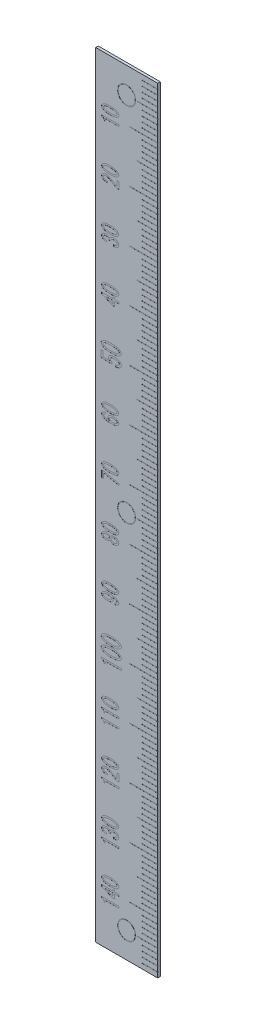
SolidWorks part; units mm, degrees
ref_plane "Front" through (0, 0, 0) normal (0, 0, 1) x (1, 0, 0)
ref_plane "Top" through (0, 0, 0) normal (0, 1, 0) x (1, 0, 0)
ref_plane "Right" through (0, 0, 0) normal (1, 0, 0) x (0, 0, -1)
sketch "Sketch1" plane through (0, 0, 0) normal (0, 0, 1) x (1, 0, 0)
  line L1 (0, 0) -> (0, 150)
  line L2 (0, 0) -> (12, 0)
  line L3 (12, 0) -> (12, 150)
  line L4 (0, 150) -> (12, 150)
  dimension "D1" = 150
  dimension "D2" = 12
extrude "Extrude1" add sketch "Sketch1" along normal blind 0.5
sketch "Sketch2" plane through (0, 0, 0.5) normal (0, 0, 1) x (1, 0, 0)
  line L0 (0, 150) -> (0, 0) construction
  line L1 (0, 0) -> (12, 0) construction
  line L2 (12, 150) -> (0, 150) construction
  circle A0 centre (6, 5) radius 1.75
  circle A1 centre (6, 145) radius 1.75
  circle A2 centre (6, 5) radius 1.65
  circle A3 centre (6, 145) radius 1.65
  circle A4 centre (6, 75) radius 1.75
  circle A5 centre (6, 75) radius 1.65
  dimension "D1" = 6
  dimension "D2" = 6
  dimension "D3" = 5
  dimension "D4" = 5
  dimension "D5" = 3.5
  dimension "D6" = 3.5
  dimension "D7" = 0.1
  dimension "D8" = 2
extrude "Extrude2" cut sketch "Sketch2" against normal blind 0.01
sketch "Sketch3" plane through (0, 0, 0.5) normal (0, 0, 1) x (1, 0, 0)
  line L0 (12, 150) -> (0, 150) construction
  line L1 (1, 138.25) -> (4.5, 138.25) construction
  line L2 (1, 138.25) -> (1, 141.75) construction
  line L3 (1, 141.75) -> (4.5, 141.75) construction
  line L4 (4.5, 138.25) -> (4.5, 141.75) construction
  line L5 (0, 150) -> (0, 0) construction
  line L6 (4.5, 128.25) -> (4.5, 131.75) construction
  line L7 (4.5, 118.25) -> (4.5, 121.75) construction
  line L8 (4.5, 108.25) -> (4.5, 111.75) construction
  line L9 (5, 98.25) -> (5, 101.75) construction
  line L10 (4.5, 88.25) -> (4.5, 91.75) construction
  line L11 (4.5, 78.25) -> (4.5, 81.75) construction
  line L12 (4.5, 68.25) -> (4.5, 71.75) construction
  line L13 (4.5, 58.25) -> (4.5, 61.75) construction
  line L14 (5, 47.2) -> (5, 52.8) construction
  line L15 (4.5, 37.2) -> (4.5, 42.8) construction
  line L16 (12, 0) -> (12, 150) construction
  line L17 (5, 50) -> (-4.9003, 50) construction
  line L18 (4.5, 27.2) -> (4.5, 32.8) construction
  line L19 (4.5, 17.2) -> (4.5, 22.8) construction
  line L20 (4.5, 7.2) -> (4.5, 12.8) construction
  text T0 "10" font "ＭＳ ゴシック" height in points 11
  text T1 "20" font "ＭＳ ゴシック" height in points 11
  text T2 "30" font "ＭＳ ゴシック" height in points 11
  text T3 "40" font "ＭＳ ゴシック" height in points 11
  text T4 "50" font "ＭＳ ゴシック" height in points 13
  text T5 "60  " font "ＭＳ ゴシック" height in points 11
  text T6 "70" font "ＭＳ ゴシック" height in points 11
  text T7 "80" font "ＭＳ ゴシック" height in points 11
  text T8 "90" font "ＭＳ ゴシック" height in points 11
  text T9 "100" font "ＭＳ ゴシック" height in points 13
  text T10 "110" font "ＭＳ ゴシック" height in points 11
  text T11 "120" font "ＭＳ ゴシック" height in points 11
  text T12 "130" font "ＭＳ ゴシック" height in points 11
  text T13 "140" font "ＭＳ ゴシック" height in points 11
  point P4 (4.5, 140)
  dimension "D1" = 3.5
  dimension "D2" = 10
  dimension "D3" = 1
  dimension "D4" = 3.5
  dimension "D8" = 5.6
  dimension "D6" = 7
  dimension "D7" = 7
  dimension "D5" = 4
extrude "Extrude3" cut sketch "Sketch3" against normal blind 0.01
sketch "Sketch4" plane through (0, 0, 0.5) normal (0, 0, 1) x (1, 0, 0)
  line L0 (12, 140.05) -> (6.5, 140.05)
  line L1 (12, 0) -> (12, 150) construction
  line L2 (6.5, 140.05) -> (6.5, 139.95)
  line L3 (6.5, 139.95) -> (12, 139.95)
  line L4 (12, 139.95) -> (12, 140.05)
  line L5 (12, 150) -> (0, 150) construction
  line L6 (12, 148.05) -> (12, 147.95)
  line L7 (12, 144.95) -> (8, 144.95)
  line L8 (12, 144.95) -> (12, 145.05)
  line L9 (12, 145.05) -> (8, 145.05)
  line L10 (8, 144.95) -> (8, 145.05)
  line L11 (12, 149.05) -> (9, 149.05)
  line L12 (12, 149.05) -> (12, 148.95)
  line L13 (12, 148.95) -> (9, 148.95)
  line L14 (9, 149.05) -> (9, 148.95)
  line L15 (12, 148.05) -> (9, 148.05)
  line L16 (12, 147.95) -> (9, 147.95)
  line L17 (9, 148.05) -> (9, 147.95)
  line L18 (12, 147.05) -> (12, 146.95)
  line L19 (12, 147.05) -> (9, 147.05)
  line L20 (12, 146.95) -> (9, 146.95)
  line L21 (9, 147.05) -> (9, 146.95)
  line L22 (12, 146.05) -> (12, 145.95)
  line L23 (12, 146.05) -> (9, 146.05)
  line L24 (12, 145.95) -> (9, 145.95)
  line L25 (9, 146.05) -> (9, 145.95)
  line L26 (12, 130.05) -> (6.5, 130.05)
  line L27 (6.5, 130.05) -> (6.5, 129.95)
  line L28 (6.5, 129.95) -> (12, 129.95)
  line L29 (12, 129.95) -> (12, 130.05)
  line L30 (12, 144.05) -> (12, 143.95)
  line L31 (12, 144.05) -> (9, 144.05)
  line L32 (12, 143.95) -> (9, 143.95)
  line L33 (9, 144.05) -> (9, 143.95)
  line L34 (12, 143.05) -> (12, 142.95)
  line L35 (12, 143.05) -> (9, 143.05)
  line L36 (12, 142.95) -> (9, 142.95)
  line L37 (9, 143.05) -> (9, 142.95)
  line L38 (12, 142.05) -> (12, 141.95)
  line L39 (12, 142.05) -> (9, 142.05)
  line L40 (12, 141.95) -> (9, 141.95)
  line L41 (9, 142.05) -> (9, 141.95)
  line L42 (12, 141.05) -> (12, 140.95)
  line L43 (12, 141.05) -> (9, 141.05)
  line L44 (12, 140.95) -> (9, 140.95)
  line L45 (9, 141.05) -> (9, 140.95)
  line L46 (9, 145.05) -> (9, 144.95)
  line L47 (12, 145.05) -> (9, 145.05)
  line L48 (12, 144.95) -> (9, 144.95)
  line L49 (12, 145.05) -> (12, 144.95)
  line L50 (12, 138.05) -> (12, 137.95)
  line L51 (12, 134.95) -> (8, 134.95)
  line L52 (12, 134.95) -> (12, 135.05)
  line L53 (12, 135.05) -> (8, 135.05)
  line L54 (8, 134.95) -> (8, 135.05)
  line L55 (12, 139.05) -> (9, 139.05)
  line L56 (12, 139.05) -> (12, 138.95)
  line L57 (12, 138.95) -> (9, 138.95)
  line L58 (9, 139.05) -> (9, 138.95)
  line L59 (12, 138.05) -> (9, 138.05)
  line L60 (12, 137.95) -> (9, 137.95)
  line L61 (9, 138.05) -> (9, 137.95)
  line L62 (12, 137.05) -> (12, 136.95)
  line L63 (12, 137.05) -> (9, 137.05)
  line L64 (12, 136.95) -> (9, 136.95)
  line L65 (9, 137.05) -> (9, 136.95)
  line L66 (12, 136.05) -> (12, 135.95)
  line L67 (12, 136.05) -> (9, 136.05)
  line L68 (12, 135.95) -> (9, 135.95)
  line L69 (9, 136.05) -> (9, 135.95)
  line L70 (12, 134.05) -> (12, 133.95)
  line L71 (12, 134.05) -> (9, 134.05)
  line L72 (12, 133.95) -> (9, 133.95)
  line L73 (9, 134.05) -> (9, 133.95)
  line L74 (12, 133.05) -> (12, 132.95)
  line L75 (12, 133.05) -> (9, 133.05)
  line L76 (12, 132.95) -> (9, 132.95)
  line L77 (9, 133.05) -> (9, 132.95)
  line L78 (12, 132.05) -> (12, 131.95)
  line L79 (12, 132.05) -> (9, 132.05)
  line L80 (12, 131.95) -> (9, 131.95)
  line L81 (9, 132.05) -> (9, 131.95)
  line L82 (12, 131.05) -> (12, 130.95)
  line L83 (12, 131.05) -> (9, 131.05)
  line L84 (12, 130.95) -> (9, 130.95)
  line L85 (9, 131.05) -> (9, 130.95)
  line L86 (12, 120.05) -> (6.5, 120.05)
  line L87 (6.5, 120.05) -> (6.5, 119.95)
  line L88 (6.5, 119.95) -> (12, 119.95)
  line L89 (12, 119.95) -> (12, 120.05)
  line L90 (12, 128.05) -> (12, 127.95)
  line L91 (12, 124.95) -> (8, 124.95)
  line L92 (12, 124.95) -> (12, 125.05)
  line L93 (12, 125.05) -> (8, 125.05)
  line L94 (8, 124.95) -> (8, 125.05)
  line L95 (12, 129.05) -> (9, 129.05)
  line L96 (12, 129.05) -> (12, 128.95)
  line L97 (12, 128.95) -> (9, 128.95)
  line L98 (9, 129.05) -> (9, 128.95)
  line L99 (12, 128.05) -> (9, 128.05)
  line L100 (12, 127.95) -> (9, 127.95)
  line L101 (9, 128.05) -> (9, 127.95)
  line L102 (12, 127.05) -> (12, 126.95)
  line L103 (12, 127.05) -> (9, 127.05)
  line L104 (12, 126.95) -> (9, 126.95)
  line L105 (9, 127.05) -> (9, 126.95)
  line L106 (12, 126.05) -> (12, 125.95)
  line L107 (12, 126.05) -> (9, 126.05)
  line L108 (12, 125.95) -> (9, 125.95)
  line L109 (9, 126.05) -> (9, 125.95)
  line L110 (12, 124.05) -> (12, 123.95)
  line L111 (12, 124.05) -> (9, 124.05)
  line L112 (12, 123.95) -> (9, 123.95)
  line L113 (9, 124.05) -> (9, 123.95)
  line L114 (12, 123.05) -> (12, 122.95)
  line L115 (12, 123.05) -> (9, 123.05)
  line L116 (12, 122.95) -> (9, 122.95)
  line L117 (9, 123.05) -> (9, 122.95)
  line L118 (12, 122.05) -> (12, 121.95)
  line L119 (12, 122.05) -> (9, 122.05)
  line L120 (12, 121.95) -> (9, 121.95)
  line L121 (9, 122.05) -> (9, 121.95)
  line L122 (12, 121.05) -> (12, 120.95)
  line L123 (12, 121.05) -> (9, 121.05)
  line L124 (12, 120.95) -> (9, 120.95)
  line L125 (9, 121.05) -> (9, 120.95)
  line L126 (12, 110.05) -> (6.5, 110.05)
  line L127 (6.5, 110.05) -> (6.5, 109.95)
  line L128 (6.5, 109.95) -> (12, 109.95)
  line L129 (12, 109.95) -> (12, 110.05)
  line L130 (12, 118.05) -> (12, 117.95)
  line L131 (12, 114.95) -> (8, 114.95)
  line L132 (12, 114.95) -> (12, 115.05)
  line L133 (12, 115.05) -> (8, 115.05)
  line L134 (8, 114.95) -> (8, 115.05)
  line L135 (12, 119.05) -> (9, 119.05)
  line L136 (12, 119.05) -> (12, 118.95)
  line L137 (12, 118.95) -> (9, 118.95)
  line L138 (9, 119.05) -> (9, 118.95)
  line L139 (12, 118.05) -> (9, 118.05)
  line L140 (12, 117.95) -> (9, 117.95)
  line L141 (9, 118.05) -> (9, 117.95)
  line L142 (12, 117.05) -> (12, 116.95)
  line L143 (12, 117.05) -> (9, 117.05)
  line L144 (12, 116.95) -> (9, 116.95)
  line L145 (9, 117.05) -> (9, 116.95)
  line L146 (12, 116.05) -> (12, 115.95)
  line L147 (12, 116.05) -> (9, 116.05)
  line L148 (12, 115.95) -> (9, 115.95)
  line L149 (9, 116.05) -> (9, 115.95)
  line L150 (12, 114.05) -> (12, 113.95)
  line L151 (12, 114.05) -> (9, 114.05)
  line L152 (12, 113.95) -> (9, 113.95)
  line L153 (9, 114.05) -> (9, 113.95)
  line L154 (12, 113.05) -> (12, 112.95)
  line L155 (12, 113.05) -> (9, 113.05)
  line L156 (12, 112.95) -> (9, 112.95)
  line L157 (9, 113.05) -> (9, 112.95)
  line L158 (12, 112.05) -> (12, 111.95)
  line L159 (12, 112.05) -> (9, 112.05)
  line L160 (12, 111.95) -> (9, 111.95)
  line L161 (9, 112.05) -> (9, 111.95)
  line L162 (12, 111.05) -> (12, 110.95)
  line L163 (12, 111.05) -> (9, 111.05)
  line L164 (12, 110.95) -> (9, 110.95)
  line L165 (9, 111.05) -> (9, 110.95)
  line L166 (12, 100.05) -> (6.5, 100.05)
  line L167 (6.5, 100.05) -> (6.5, 99.95)
  line L168 (6.5, 99.95) -> (12, 99.95)
  line L169 (12, 99.95) -> (12, 100.05)
  line L170 (12, 108.05) -> (12, 107.95)
  line L171 (12, 104.95) -> (8, 104.95)
  line L172 (12, 104.95) -> (12, 105.05)
  line L173 (12, 105.05) -> (8, 105.05)
  line L174 (8, 104.95) -> (8, 105.05)
  line L175 (12, 109.05) -> (9, 109.05)
  line L176 (12, 109.05) -> (12, 108.95)
  line L177 (12, 108.95) -> (9, 108.95)
  line L178 (9, 109.05) -> (9, 108.95)
  line L179 (12, 108.05) -> (9, 108.05)
  line L180 (12, 107.95) -> (9, 107.95)
  line L181 (9, 108.05) -> (9, 107.95)
  line L182 (12, 107.05) -> (12, 106.95)
  line L183 (12, 107.05) -> (9, 107.05)
  line L184 (12, 106.95) -> (9, 106.95)
  line L185 (9, 107.05) -> (9, 106.95)
  line L186 (12, 106.05) -> (12, 105.95)
  line L187 (12, 106.05) -> (9, 106.05)
  line L188 (12, 105.95) -> (9, 105.95)
  line L189 (9, 106.05) -> (9, 105.95)
  line L190 (12, 104.05) -> (12, 103.95)
  line L191 (12, 104.05) -> (9, 104.05)
  line L192 (12, 103.95) -> (9, 103.95)
  line L193 (9, 104.05) -> (9, 103.95)
  line L194 (12, 103.05) -> (12, 102.95)
  line L195 (12, 103.05) -> (9, 103.05)
  line L196 (12, 102.95) -> (9, 102.95)
  line L197 (9, 103.05) -> (9, 102.95)
  line L198 (12, 102.05) -> (12, 101.95)
  line L199 (12, 102.05) -> (9, 102.05)
  line L200 (12, 101.95) -> (9, 101.95)
  line L201 (9, 102.05) -> (9, 101.95)
  line L202 (12, 101.05) -> (12, 100.95)
  line L203 (12, 101.05) -> (9, 101.05)
  line L204 (12, 100.95) -> (9, 100.95)
  line L205 (9, 101.05) -> (9, 100.95)
  line L206 (12, 100.05) -> (6.5, 100.05)
  line L207 (6.5, 100.05) -> (6.5, 99.95)
  line L208 (6.5, 99.95) -> (12, 99.95)
  line L209 (12, 99.95) -> (12, 100.05)
  line L210 (12, 98.05) -> (12, 97.95)
  line L211 (12, 94.95) -> (8, 94.95)
  line L212 (12, 94.95) -> (12, 95.05)
  line L213 (12, 95.05) -> (8, 95.05)
  line L214 (8, 94.95) -> (8, 95.05)
  line L215 (12, 99.05) -> (9, 99.05)
  line L216 (12, 99.05) -> (12, 98.95)
  line L217 (12, 98.95) -> (9, 98.95)
  line L218 (9, 99.05) -> (9, 98.95)
  line L219 (12, 98.05) -> (9, 98.05)
  line L220 (12, 97.95) -> (9, 97.95)
  line L221 (9, 98.05) -> (9, 97.95)
  line L222 (12, 97.05) -> (12, 96.95)
  line L223 (12, 97.05) -> (9, 97.05)
  line L224 (12, 96.95) -> (9, 96.95)
  line L225 (9, 97.05) -> (9, 96.95)
  line L226 (12, 96.05) -> (12, 95.95)
  line L227 (12, 96.05) -> (9, 96.05)
  line L228 (12, 95.95) -> (9, 95.95)
  line L229 (9, 96.05) -> (9, 95.95)
  line L230 (12, 94.05) -> (12, 93.95)
  line L231 (12, 94.05) -> (9, 94.05)
  line L232 (12, 93.95) -> (9, 93.95)
  line L233 (9, 94.05) -> (9, 93.95)
  line L234 (12, 93.05) -> (12, 92.95)
  line L235 (12, 93.05) -> (9, 93.05)
  line L236 (12, 92.95) -> (9, 92.95)
  line L237 (9, 93.05) -> (9, 92.95)
  line L238 (12, 92.05) -> (12, 91.95)
  line L239 (12, 92.05) -> (9, 92.05)
  line L240 (12, 91.95) -> (9, 91.95)
  line L241 (9, 92.05) -> (9, 91.95)
  line L242 (12, 91.05) -> (12, 90.95)
  line L243 (12, 91.05) -> (9, 91.05)
  line L244 (12, 90.95) -> (9, 90.95)
  line L245 (9, 91.05) -> (9, 90.95)
  line L246 (12, 90.05) -> (6.5, 90.05)
  line L247 (6.5, 90.05) -> (6.5, 89.95)
  line L248 (6.5, 89.95) -> (12, 89.95)
  line L249 (12, 89.95) -> (12, 90.05)
  line L250 (12, 88.05) -> (12, 87.95)
  line L251 (12, 84.95) -> (8, 84.95)
  line L252 (12, 84.95) -> (12, 85.05)
  line L253 (12, 85.05) -> (8, 85.05)
  line L254 (8, 84.95) -> (8, 85.05)
  line L255 (12, 89.05) -> (9, 89.05)
  line L256 (12, 89.05) -> (12, 88.95)
  line L257 (12, 88.95) -> (9, 88.95)
  line L258 (9, 89.05) -> (9, 88.95)
  line L259 (12, 88.05) -> (9, 88.05)
  line L260 (12, 87.95) -> (9, 87.95)
  line L261 (9, 88.05) -> (9, 87.95)
  line L262 (12, 87.05) -> (12, 86.95)
  line L263 (12, 87.05) -> (9, 87.05)
  line L264 (12, 86.95) -> (9, 86.95)
  line L265 (9, 87.05) -> (9, 86.95)
  line L266 (12, 86.05) -> (12, 85.95)
  line L267 (12, 86.05) -> (9, 86.05)
  line L268 (12, 85.95) -> (9, 85.95)
  line L269 (9, 86.05) -> (9, 85.95)
  line L270 (12, 84.05) -> (12, 83.95)
  line L271 (12, 84.05) -> (9, 84.05)
  line L272 (12, 83.95) -> (9, 83.95)
  line L273 (9, 84.05) -> (9, 83.95)
  line L274 (12, 83.05) -> (12, 82.95)
  line L275 (12, 83.05) -> (9, 83.05)
  line L276 (12, 82.95) -> (9, 82.95)
  line L277 (9, 83.05) -> (9, 82.95)
  line L278 (12, 82.05) -> (12, 81.95)
  line L279 (12, 82.05) -> (9, 82.05)
  line L280 (12, 81.95) -> (9, 81.95)
  line L281 (9, 82.05) -> (9, 81.95)
  line L282 (12, 81.05) -> (12, 80.95)
  line L283 (12, 81.05) -> (9, 81.05)
  line L284 (12, 80.95) -> (9, 80.95)
  line L285 (9, 81.05) -> (9, 80.95)
  line L286 (12, 80.05) -> (6.5, 80.05)
  line L287 (6.5, 80.05) -> (6.5, 79.95)
  line L288 (6.5, 79.95) -> (12, 79.95)
  line L289 (12, 79.95) -> (12, 80.05)
  line L290 (12, 78.05) -> (12, 77.95)
  line L291 (12, 74.95) -> (8, 74.95)
  line L292 (12, 74.95) -> (12, 75.05)
  line L293 (12, 75.05) -> (8, 75.05)
  line L294 (8, 74.95) -> (8, 75.05)
  line L295 (12, 79.05) -> (9, 79.05)
  line L296 (12, 79.05) -> (12, 78.95)
  line L297 (12, 78.95) -> (9, 78.95)
  line L298 (9, 79.05) -> (9, 78.95)
  line L299 (12, 78.05) -> (9, 78.05)
  line L300 (12, 77.95) -> (9, 77.95)
  line L301 (9, 78.05) -> (9, 77.95)
  line L302 (12, 77.05) -> (12, 76.95)
  line L303 (12, 77.05) -> (9, 77.05)
  line L304 (12, 76.95) -> (9, 76.95)
  line L305 (9, 77.05) -> (9, 76.95)
  line L306 (12, 76.05) -> (12, 75.95)
  line L307 (12, 76.05) -> (9, 76.05)
  line L308 (12, 75.95) -> (9, 75.95)
  line L309 (9, 76.05) -> (9, 75.95)
  line L310 (12, 74.05) -> (12, 73.95)
  line L311 (12, 74.05) -> (9, 74.05)
  line L312 (12, 73.95) -> (9, 73.95)
  line L313 (9, 74.05) -> (9, 73.95)
  line L314 (12, 73.05) -> (12, 72.95)
  line L315 (12, 73.05) -> (9, 73.05)
  line L316 (12, 72.95) -> (9, 72.95)
  line L317 (9, 73.05) -> (9, 72.95)
  line L318 (12, 72.05) -> (12, 71.95)
  line L319 (12, 72.05) -> (9, 72.05)
  line L320 (12, 71.95) -> (9, 71.95)
  line L321 (9, 72.05) -> (9, 71.95)
  line L322 (12, 71.05) -> (12, 70.95)
  line L323 (12, 71.05) -> (9, 71.05)
  line L324 (12, 70.95) -> (9, 70.95)
  line L325 (9, 71.05) -> (9, 70.95)
  line L326 (12, 70.05) -> (6.5, 70.05)
  line L327 (6.5, 70.05) -> (6.5, 69.95)
  line L328 (6.5, 69.95) -> (12, 69.95)
  line L329 (12, 69.95) -> (12, 70.05)
  line L330 (12, 68.05) -> (12, 67.95)
  line L331 (12, 64.95) -> (8, 64.95)
  line L332 (12, 64.95) -> (12, 65.05)
  line L333 (12, 65.05) -> (8, 65.05)
  line L334 (8, 64.95) -> (8, 65.05)
  line L335 (12, 69.05) -> (9, 69.05)
  line L336 (12, 69.05) -> (12, 68.95)
  line L337 (12, 68.95) -> (9, 68.95)
  line L338 (9, 69.05) -> (9, 68.95)
  line L339 (12, 68.05) -> (9, 68.05)
  line L340 (12, 67.95) -> (9, 67.95)
  line L341 (9, 68.05) -> (9, 67.95)
  line L342 (12, 67.05) -> (12, 66.95)
  line L343 (12, 67.05) -> (9, 67.05)
  line L344 (12, 66.95) -> (9, 66.95)
  line L345 (9, 67.05) -> (9, 66.95)
  line L346 (12, 66.05) -> (12, 65.95)
  line L347 (12, 66.05) -> (9, 66.05)
  line L348 (12, 65.95) -> (9, 65.95)
  line L349 (9, 66.05) -> (9, 65.95)
  line L350 (12, 64.05) -> (12, 63.95)
  line L351 (12, 64.05) -> (9, 64.05)
  line L352 (12, 63.95) -> (9, 63.95)
  line L353 (9, 64.05) -> (9, 63.95)
  line L354 (12, 63.05) -> (12, 62.95)
  line L355 (12, 63.05) -> (9, 63.05)
  line L356 (12, 62.95) -> (9, 62.95)
  line L357 (9, 63.05) -> (9, 62.95)
  line L358 (12, 62.05) -> (12, 61.95)
  line L359 (12, 62.05) -> (9, 62.05)
  line L360 (12, 61.95) -> (9, 61.95)
  line L361 (9, 62.05) -> (9, 61.95)
  line L362 (12, 61.05) -> (12, 60.95)
  line L363 (12, 61.05) -> (9, 61.05)
  line L364 (12, 60.95) -> (9, 60.95)
  line L365 (9, 61.05) -> (9, 60.95)
  line L366 (12, 60.05) -> (6.5, 60.05)
  line L367 (6.5, 60.05) -> (6.5, 59.95)
  line L368 (6.5, 59.95) -> (12, 59.95)
  line L369 (12, 59.95) -> (12, 60.05)
  line L370 (12, 58.05) -> (12, 57.95)
  line L371 (12, 54.95) -> (8, 54.95)
  line L372 (12, 54.95) -> (12, 55.05)
  line L373 (12, 55.05) -> (8, 55.05)
  line L374 (8, 54.95) -> (8, 55.05)
  line L375 (12, 59.05) -> (9, 59.05)
  line L376 (12, 59.05) -> (12, 58.95)
  line L377 (12, 58.95) -> (9, 58.95)
  line L378 (9, 59.05) -> (9, 58.95)
  line L379 (12, 58.05) -> (9, 58.05)
  line L380 (12, 57.95) -> (9, 57.95)
  line L381 (9, 58.05) -> (9, 57.95)
  line L382 (12, 57.05) -> (12, 56.95)
  line L383 (12, 57.05) -> (9, 57.05)
  line L384 (12, 56.95) -> (9, 56.95)
  line L385 (9, 57.05) -> (9, 56.95)
  line L386 (12, 56.05) -> (12, 55.95)
  line L387 (12, 56.05) -> (9, 56.05)
  line L388 (12, 55.95) -> (9, 55.95)
  line L389 (9, 56.05) -> (9, 55.95)
  line L390 (12, 54.05) -> (12, 53.95)
  line L391 (12, 54.05) -> (9, 54.05)
  line L392 (12, 53.95) -> (9, 53.95)
  line L393 (9, 54.05) -> (9, 53.95)
  line L394 (12, 53.05) -> (12, 52.95)
  line L395 (12, 53.05) -> (9, 53.05)
  line L396 (12, 52.95) -> (9, 52.95)
  line L397 (9, 53.05) -> (9, 52.95)
  line L398 (12, 52.05) -> (12, 51.95)
  line L399 (12, 52.05) -> (9, 52.05)
  line L400 (12, 51.95) -> (9, 51.95)
  line L401 (9, 52.05) -> (9, 51.95)
  line L402 (12, 51.05) -> (12, 50.95)
  line L403 (12, 51.05) -> (9, 51.05)
  line L404 (12, 50.95) -> (9, 50.95)
  line L405 (9, 51.05) -> (9, 50.95)
  line L406 (12, 50.05) -> (6.5, 50.05)
  line L407 (6.5, 50.05) -> (6.5, 49.95)
  line L408 (6.5, 49.95) -> (12, 49.95)
  line L409 (12, 49.95) -> (12, 50.05)
  line L410 (12, 48.05) -> (12, 47.95)
  line L411 (12, 44.95) -> (8, 44.95)
  line L412 (12, 44.95) -> (12, 45.05)
  line L413 (12, 45.05) -> (8, 45.05)
  line L414 (8, 44.95) -> (8, 45.05)
  line L415 (12, 49.05) -> (9, 49.05)
  line L416 (12, 49.05) -> (12, 48.95)
  line L417 (12, 48.95) -> (9, 48.95)
  line L418 (9, 49.05) -> (9, 48.95)
  line L419 (12, 48.05) -> (9, 48.05)
  line L420 (12, 47.95) -> (9, 47.95)
  line L421 (9, 48.05) -> (9, 47.95)
  line L422 (12, 47.05) -> (12, 46.95)
  line L423 (12, 47.05) -> (9, 47.05)
  line L424 (12, 46.95) -> (9, 46.95)
  line L425 (9, 47.05) -> (9, 46.95)
  line L426 (12, 46.05) -> (12, 45.95)
  line L427 (12, 46.05) -> (9, 46.05)
  line L428 (12, 45.95) -> (9, 45.95)
  line L429 (9, 46.05) -> (9, 45.95)
  line L430 (12, 44.05) -> (12, 43.95)
  line L431 (12, 44.05) -> (9, 44.05)
  line L432 (12, 43.95) -> (9, 43.95)
  line L433 (9, 44.05) -> (9, 43.95)
  line L434 (12, 43.05) -> (12, 42.95)
  line L435 (12, 43.05) -> (9, 43.05)
  line L436 (12, 42.95) -> (9, 42.95)
  line L437 (9, 43.05) -> (9, 42.95)
  line L438 (12, 42.05) -> (12, 41.95)
  line L439 (12, 42.05) -> (9, 42.05)
  line L440 (12, 41.95) -> (9, 41.95)
  line L441 (9, 42.05) -> (9, 41.95)
  line L442 (12, 41.05) -> (12, 40.95)
  line L443 (12, 41.05) -> (9, 41.05)
  line L444 (12, 40.95) -> (9, 40.95)
  line L445 (9, 41.05) -> (9, 40.95)
  line L446 (12, 40.05) -> (6.5, 40.05)
  line L447 (6.5, 40.05) -> (6.5, 39.95)
  line L448 (6.5, 39.95) -> (12, 39.95)
  line L449 (12, 39.95) -> (12, 40.05)
  line L450 (12, 38.05) -> (12, 37.95)
  line L451 (12, 34.95) -> (8, 34.95)
  line L452 (12, 34.95) -> (12, 35.05)
  line L453 (12, 35.05) -> (8, 35.05)
  line L454 (8, 34.95) -> (8, 35.05)
  line L455 (12, 39.05) -> (9, 39.05)
  line L456 (12, 39.05) -> (12, 38.95)
  line L457 (12, 38.95) -> (9, 38.95)
  line L458 (9, 39.05) -> (9, 38.95)
  line L459 (12, 38.05) -> (9, 38.05)
  line L460 (12, 37.95) -> (9, 37.95)
  line L461 (9, 38.05) -> (9, 37.95)
  line L462 (12, 37.05) -> (12, 36.95)
  line L463 (12, 37.05) -> (9, 37.05)
  line L464 (12, 36.95) -> (9, 36.95)
  line L465 (9, 37.05) -> (9, 36.95)
  line L466 (12, 36.05) -> (12, 35.95)
  line L467 (12, 36.05) -> (9, 36.05)
  line L468 (12, 35.95) -> (9, 35.95)
  line L469 (9, 36.05) -> (9, 35.95)
  line L470 (12, 34.05) -> (12, 33.95)
  line L471 (12, 34.05) -> (9, 34.05)
  line L472 (12, 33.95) -> (9, 33.95)
  line L473 (9, 34.05) -> (9, 33.95)
  line L474 (12, 33.05) -> (12, 32.95)
  line L475 (12, 33.05) -> (9, 33.05)
  line L476 (12, 32.95) -> (9, 32.95)
  line L477 (9, 33.05) -> (9, 32.95)
  line L478 (12, 32.05) -> (12, 31.95)
  line L479 (12, 32.05) -> (9, 32.05)
  line L480 (12, 31.95) -> (9, 31.95)
  line L481 (9, 32.05) -> (9, 31.95)
  line L482 (12, 31.05) -> (12, 30.95)
  line L483 (12, 31.05) -> (9, 31.05)
  line L484 (12, 30.95) -> (9, 30.95)
  line L485 (9, 31.05) -> (9, 30.95)
  line L486 (12, 30.05) -> (6.5, 30.05)
  line L487 (6.5, 30.05) -> (6.5, 29.95)
  line L488 (6.5, 29.95) -> (12, 29.95)
  line L489 (12, 29.95) -> (12, 30.05)
  line L490 (12, 28.05) -> (12, 27.95)
  line L491 (12, 24.95) -> (8, 24.95)
  line L492 (12, 24.95) -> (12, 25.05)
  line L493 (12, 25.05) -> (8, 25.05)
  line L494 (8, 24.95) -> (8, 25.05)
  line L495 (12, 29.05) -> (9, 29.05)
  line L496 (12, 29.05) -> (12, 28.95)
  line L497 (12, 28.95) -> (9, 28.95)
  line L498 (9, 29.05) -> (9, 28.95)
  line L499 (12, 28.05) -> (9, 28.05)
  line L500 (12, 27.95) -> (9, 27.95)
  line L501 (9, 28.05) -> (9, 27.95)
  line L502 (12, 27.05) -> (12, 26.95)
  line L503 (12, 27.05) -> (9, 27.05)
  line L504 (12, 26.95) -> (9, 26.95)
  line L505 (9, 27.05) -> (9, 26.95)
  line L506 (12, 26.05) -> (12, 25.95)
  line L507 (12, 26.05) -> (9, 26.05)
  line L508 (12, 25.95) -> (9, 25.95)
  line L509 (9, 26.05) -> (9, 25.95)
  line L510 (12, 24.05) -> (12, 23.95)
  line L511 (12, 24.05) -> (9, 24.05)
  line L512 (12, 23.95) -> (9, 23.95)
  line L513 (9, 24.05) -> (9, 23.95)
  line L514 (12, 23.05) -> (12, 22.95)
  line L515 (12, 23.05) -> (9, 23.05)
  line L516 (12, 22.95) -> (9, 22.95)
  line L517 (9, 23.05) -> (9, 22.95)
  line L518 (12, 22.05) -> (12, 21.95)
  line L519 (12, 22.05) -> (9, 22.05)
  line L520 (12, 21.95) -> (9, 21.95)
  line L521 (9, 22.05) -> (9, 21.95)
  line L522 (12, 21.05) -> (12, 20.95)
  line L523 (12, 21.05) -> (9, 21.05)
  line L524 (12, 20.95) -> (9, 20.95)
  line L525 (9, 21.05) -> (9, 20.95)
  line L526 (12, 20.05) -> (6.5, 20.05)
  line L527 (6.5, 20.05) -> (6.5, 19.95)
  line L528 (6.5, 19.95) -> (12, 19.95)
  line L529 (12, 19.95) -> (12, 20.05)
  line L530 (12, 18.05) -> (12, 17.95)
  line L531 (12, 14.95) -> (8, 14.95)
  line L532 (12, 14.95) -> (12, 15.05)
  line L533 (12, 15.05) -> (8, 15.05)
  line L534 (8, 14.95) -> (8, 15.05)
  line L535 (12, 19.05) -> (9, 19.05)
  line L536 (12, 19.05) -> (12, 18.95)
  line L537 (12, 18.95) -> (9, 18.95)
  line L538 (9, 19.05) -> (9, 18.95)
  line L539 (12, 18.05) -> (9, 18.05)
  line L540 (12, 17.95) -> (9, 17.95)
  line L541 (9, 18.05) -> (9, 17.95)
  line L542 (12, 17.05) -> (12, 16.95)
  line L543 (12, 17.05) -> (9, 17.05)
  line L544 (12, 16.95) -> (9, 16.95)
  line L545 (9, 17.05) -> (9, 16.95)
  line L546 (12, 16.05) -> (12, 15.95)
  line L547 (12, 16.05) -> (9, 16.05)
  line L548 (12, 15.95) -> (9, 15.95)
  line L549 (9, 16.05) -> (9, 15.95)
  line L550 (12, 14.05) -> (12, 13.95)
  line L551 (12, 14.05) -> (9, 14.05)
  line L552 (12, 13.95) -> (9, 13.95)
  line L553 (9, 14.05) -> (9, 13.95)
  line L554 (12, 13.05) -> (12, 12.95)
  line L555 (12, 13.05) -> (9, 13.05)
  line L556 (12, 12.95) -> (9, 12.95)
  line L557 (9, 13.05) -> (9, 12.95)
  line L558 (12, 12.05) -> (12, 11.95)
  line L559 (12, 12.05) -> (9, 12.05)
  line L560 (12, 11.95) -> (9, 11.95)
  line L561 (9, 12.05) -> (9, 11.95)
  line L562 (12, 11.05) -> (12, 10.95)
  line L563 (12, 11.05) -> (9, 11.05)
  line L564 (12, 10.95) -> (9, 10.95)
  line L565 (9, 11.05) -> (9, 10.95)
  line L566 (12, 10.05) -> (6.5, 10.05)
  line L567 (6.5, 10.05) -> (6.5, 9.95)
  line L568 (6.5, 9.95) -> (12, 9.95)
  line L569 (12, 9.95) -> (12, 10.05)
  line L570 (12, 8.05) -> (12, 7.95)
  line L571 (12, 4.95) -> (8, 4.95)
  line L572 (12, 4.95) -> (12, 5.05)
  line L573 (12, 5.05) -> (8, 5.05)
  line L574 (8, 4.95) -> (8, 5.05)
  line L575 (12, 9.05) -> (9, 9.05)
  line L576 (12, 9.05) -> (12, 8.95)
  line L577 (12, 8.95) -> (9, 8.95)
  line L578 (9, 9.05) -> (9, 8.95)
  line L579 (12, 8.05) -> (9, 8.05)
  line L580 (12, 7.95) -> (9, 7.95)
  line L581 (9, 8.05) -> (9, 7.95)
  line L582 (12, 7.05) -> (12, 6.95)
  line L583 (12, 7.05) -> (9, 7.05)
  line L584 (12, 6.95) -> (9, 6.95)
  line L585 (9, 7.05) -> (9, 6.95)
  line L586 (12, 6.05) -> (12, 5.95)
  line L587 (12, 6.05) -> (9, 6.05)
  line L588 (12, 5.95) -> (9, 5.95)
  line L589 (9, 6.05) -> (9, 5.95)
  line L590 (12, 4.05) -> (12, 3.95)
  line L591 (12, 4.05) -> (9, 4.05)
  line L592 (12, 3.95) -> (9, 3.95)
  line L593 (9, 4.05) -> (9, 3.95)
  line L594 (12, 3.05) -> (12, 2.95)
  line L595 (12, 3.05) -> (9, 3.05)
  line L596 (12, 2.95) -> (9, 2.95)
  line L597 (9, 3.05) -> (9, 2.95)
  line L598 (12, 2.05) -> (12, 1.95)
  line L599 (12, 2.05) -> (9, 2.05)
  line L600 (12, 1.95) -> (9, 1.95)
  line L601 (9, 2.05) -> (9, 1.95)
  line L602 (12, 1.05) -> (12, 0.95)
  line L603 (12, 1.05) -> (9, 1.05)
  line L604 (12, 0.95) -> (9, 0.95)
  line L605 (9, 1.05) -> (9, 0.95)
  point P4 (12, 140)
  point P13 (12, 145)
  point P18 (12, 149)
  dimension "D1" = 10
  dimension "D2" = 0.1
  dimension "D3" = 5.5
  dimension "D4" = 5
  dimension "D5" = 0.1
  dimension "D6" = 1
  dimension "D7" = 0.1
  dimension "D8" = 3
  dimension "D9" = 4
  dimension "D10" = 9
  dimension "D11" = 5
  dimension "D12" = 6
  dimension "D13" = 6
extrude "Extrude4" cut sketch "Sketch4" against normal blind 0.01
move or copy body "Body-Move/Copy2" bodies to move or copy 105 copy no translate (-12, -150, 0)
